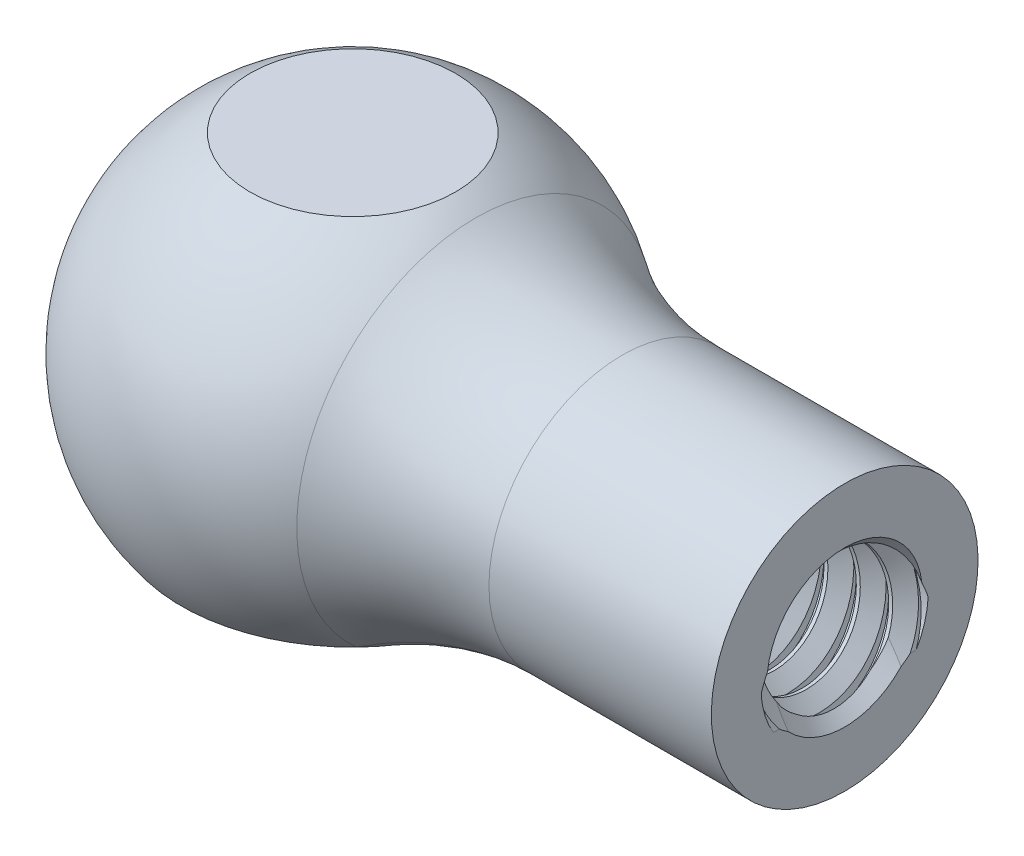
SolidWorks part; units mm, degrees
ref_plane "Front" through (0, 0, 0) normal (0, 0, 1) x (1, 0, 0)
ref_plane "Top" through (0, 0, 0) normal (0, 1, 0) x (1, 0, 0)
ref_plane "Right" through (0, 0, 0) normal (1, 0, 0) x (0, 0, -1)
sketch "Sketch1" plane through (0, 0, 0) normal (0, 0, 1) x (1, 0, 0)
  line L0 (-2.8867, 5.15) -> (9.5, 5.15)
  line L1 (9.5, 5.15) -> (9.5, 0)
  line L2 (9.5, -5.15) -> (-2.8867, -5.15) construction
  line L3 (0, 0) -> (-9.5, 0)
  line L4 (0, 0) -> (9.5, 0)
  line L5 (-2.8867, 5.15) -> (-2.8867, -5.15) construction
  line L7 (9.5, 0) -> (9.5, -5.15) construction
  line L8 (9.5, 0) -> (14.65, 0) construction
  line L9 (-16.1133, -5.15) -> (-2.8867, -5.15) construction
  line L11 (-17.882, 0) -> (-9.5, 0)
  arc A0 (-17.882, 0) -> (-1.118, 0) centre (-9.5, 0) ccw construction
  arc A4 (-2.8867, 5.15) -> (-17.882, 0) centre (-9.5, 0) ccw
  dimension "D1" = 8.382
  dimension "D2" = 19
  dimension "D4" = 10.3
revolve "Revolve1" add sketch "Sketch1" angle 360 about L8
sketch "Sketch2" plane through (0, 0, 0) normal (0, 0, 1) x (1, 0, 0)
  line L0 (-14.5, -5.15) -> (-14.5, 0)
  line L1 (-16.1133, -5.15) -> (-2.8867, -5.15) construction
  line L2 (-9.5, -8.382) -> (-9.5, -9.9953) construction
  line L4 (-16.1133, -5.15) -> (-14.5, -5.15)
  line L5 (-9.5, 5) -> (-9.5, -8.382)
  line L6 (-9.5, 8.382) -> (-14.5, 8.382)
  line L7 (-9.5, 8.382) -> (-9.5, 7.382)
  line L8 (-9.5, 7.382) -> (-14.5, 7.382)
  line L9 (-14.5, 8.382) -> (-14.5, 7.382)
  arc A0 (-14.5, 0) -> (-9.5, 5) centre (-9.5, 0) cw
  arc A1 (-16.1133, -5.15) -> (-9.5, -8.382) centre (-9.5, 0) ccw
  arc A2 (-17.882, 0) -> (-1.118, 0) centre (-9.5, 0) ccw construction
  arc A3 (-2.8867, 5.15) -> (-17.882, 0) centre (-9.5, 0) ccw construction
  dimension "D1" = 10
  dimension "D2" = 1
revolve "Cut-Revolve1" cut sketch "Sketch2" angle 360 about L2
sketch "Sketch3" plane through (0, 0, 0) normal (0, 0, 1) x (1, 0, 0)
  line L0 (1, 3) -> (1, -3) construction
  line L1 (1, -3) -> (2.25, -3) construction
  line L2 (2.25, -3) -> (1, 3) construction
  line L3 (1, 3) -> (1.3059, 3.0637)
  line L4 (1.3059, 3.0637) -> (2.2237, 3.2549) construction
  line L5 (2.2237, 3.2549) -> (1.9793, 2.5129)
  line L6 (1.9793, 2.5129) -> (1.8263, 2.481)
  line L7 (1.8263, 2.481) -> (1.3059, 3.0637)
  line L8 (1.7648, 3.1593) -> (1.9028, 2.497) construction
  line L9 (1, 3) -> (1.798, 3) construction
  line L10 (1.798, 3) -> (3.048, -3) construction
  line L11 (3.048, -3) -> (2.25, -3) construction
  line L12 (1, -0.2965) -> (3.846, 0.2965) construction
  line L13 (9.5, 5.15) -> (9.5, 0) construction
  line L16 (2.423, 0) -> (1, 0) construction
  line L17 (0, 0) -> (9.5, 0) construction
  line L18 (1, 3) -> (1.6582, -0.1593)
  line L19 (1.6582, -0.1593) -> (2.8819, 0.0956)
  line L20 (2.8819, 0.0956) -> (2.2237, 3.2549)
  point P13 (2.423, 0)
  dimension "D1" = 0.3125
  dimension "D2" = 0.1562
  dimension "D3" = 1.25
  dimension "D4" = 1.25
  dimension "D5" = 60
  dimension "D6" = 6
  dimension "D7" = 8.5
revolve "Cut-Revolve2" cut sketch "Sketch3" angle 360 about L12
sketch "Sketch4" plane through (9.5, 0, 0) normal (1, 0, 0) x (0, 0, -1)
  circle A0 centre (0, 0) radius 3
  dimension "D1" = 6
extrude "Cut-Extrude1" cut sketch "Sketch4" against normal through all draft 45
pattern_linear "LPattern1" count 7 spacing 1.25 along (1, 0, 0) of "Cut-Revolve2"
fillet "Fillet1" radius 10 1 edges at (-2.8867, -5.15, 0)
sketch "Sketch5" plane through (0, 7.382, 0) normal (0, 1, 0) x (1, 0, 0)
  circle A0 centre (-9.5, 0) radius 3.9704 construction
  circle A1 centre (-9.5, 0) radius 3.9704
